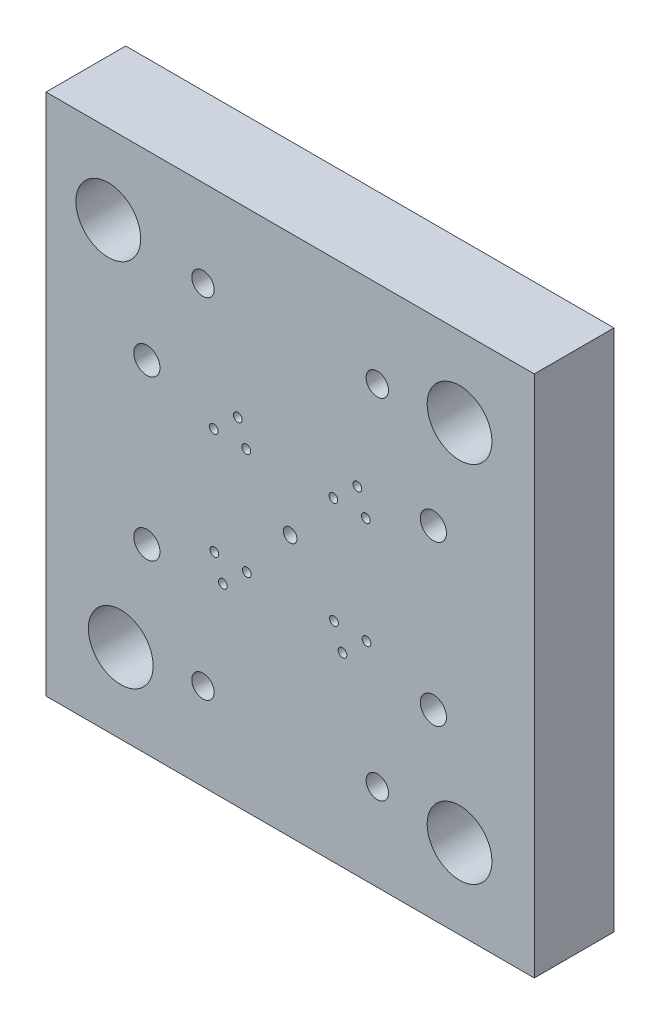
SolidWorks part; units mm, degrees
ref_plane "Plan de face" through (0, 0, 0) normal (0, 0, 1) x (1, 0, 0)
ref_plane "Plan de dessus" through (0, 0, 0) normal (0, 1, 0) x (1, 0, 0)
ref_plane "Plan de droite" through (0, 0, 0) normal (1, 0, 0) x (0, 0, -1)
sketch "Esquisse1" plane through (0, 0, 0) normal (0, 0, 1) x (1, 0, 0)
  line L1 (0, 0) -> (196, 0)
  line L2 (0, 0) -> (0, 210)
  line L3 (0, 210) -> (196, 210)
  line L4 (196, 0) -> (196, 210)
  dimension "D1" = 210
  dimension "D2" = 196
extrude "Extrusion1" add sketch "Esquisse1" along normal blind 32
sketch "Esquisse3" plane through (0, 0, 0) normal (0, 0, -1) x (-1, 0, 0)
  line L0 (-98, 210) -> (-98, 0) construction
  line L1 (-196, 210) -> (0, 210) construction
  line L2 (0, 0) -> (-196, 0) construction
  line L3 (-196, 105) -> (0, 105) construction
  line L4 (-196, 0) -> (-196, 210) construction
  line L5 (0, 210) -> (0, 0) construction
  line L6 (-214.75, 178) -> (45.0645, 178) construction
  line L7 (-218.7232, 32) -> (22.112, 32) construction
  line L8 (-166, 220.8332) -> (-166, -13.5838) construction
  line L9 (-30, 217.4713) -> (-30, -13.5838) construction
  line L10 (-25, 197.6571) -> (-25, 137.5989) construction
  circle A0 centre (-25, 178) radius 13
  circle A1 centre (-30, 32) radius 13
  circle A2 centre (-166, 32) radius 13
  circle A3 centre (-166, 178) radius 13
  dimension "D6" = 73
  dimension "D7" = 26
  dimension "D9" = 26
  dimension "D5" = 26
  dimension "D8" = 26
  dimension "D1" = 73
  dimension "D2" = 73
  dimension "D3" = 68
  dimension "D4" = 68
extrude "Enlèv. mat.-Extru.1" cut sketch "Esquisse3" against normal through all
sketch "Esquisse17" plane through (0, 0, 0) normal (0, 0, -1) x (-1, 0, 0)
  line L0 (-197.2908, 105) -> (0, 105) construction
  line L1 (0, 210) -> (0, 0) construction
  line L2 (-98, 210) -> (-98, 0) construction
  line L3 (-196, 210) -> (0, 210) construction
  line L4 (0, 0) -> (-196, 0) construction
  circle A0 centre (-40.5, 137) radius 5.25
  circle A1 centre (-40.5, 73) radius 5.25
  circle A2 centre (-155.5, 73) radius 5.25
  circle A3 centre (-155.5, 137) radius 5.25
  circle A4 centre (-98, 105) radius 2.75
  dimension "D1" = 10.5
  dimension "D2" = 10.5
  dimension "D3" = 10.5
  dimension "D4" = 10.5
  dimension "D5" = 32
  dimension "D6" = 32
  dimension "D7" = 32
  dimension "D9" = 57.5
  dimension "D10" = 57.5
  dimension "D11" = 57.5
  dimension "D13" = 5.5
  dimension "D8" = 32
  dimension "D12" = 57.5
extrude "Enlèv. mat.-Extru.9" cut sketch "Esquisse17" against normal through all
sketch "Esquisse19" plane through (0, 0, 0) normal (0, 0, -1) x (-1, 0, 0)
  line L0 (-98, 210) -> (-98, 0) construction
  line L1 (-196, 210) -> (0, 210) construction
  line L2 (0, 0) -> (-196, 0) construction
  line L3 (0, 105) -> (-196, 105) construction
  line L4 (0, 210) -> (0, 0) construction
  line L5 (-196, 0) -> (-196, 210) construction
  circle A1 centre (-67.36, 126.58) radius 1.75
  circle A2 centre (-80.41, 126.07) radius 1.75
  circle A3 centre (-76.99, 135.41) radius 1.75
  circle A4 centre (-67.59, 83.93) radius 1.75
  circle A5 centre (-71.01, 74.59) radius 1.75
  circle A6 centre (-80.64, 83.42) radius 1.75
  circle A7 centre (-128.64, 83.42) radius 1.75
  circle A8 centre (-115.59, 83.93) radius 1.75
  circle A9 centre (-119.01, 74.59) radius 1.75
  circle A13 centre (-124.99, 135.41) radius 1.75
  circle A14 centre (-128.41, 126.07) radius 1.75
  circle A15 centre (-115.36, 126.58) radius 1.75
  dimension "D7" = 3.5
  dimension "D8" = 3.5
  dimension "D9" = 3.5
  dimension "D16" = 3.5
  dimension "D17" = 3.5
  dimension "D18" = 3.5
  dimension "D1" = 21.58
  dimension "D2" = 30.41
  dimension "D3" = 21.07
  dimension "D4" = 30.64
  dimension "D5" = 21.01
  dimension "D6" = 17.59
  dimension "D10" = 21.07
  dimension "D11" = 21.58
  dimension "D12" = 30.41
  dimension "D13" = 30.41
  dimension "D14" = 26.99
  dimension "D15" = 17.36
extrude "Enlèv. mat.-Extru.10" cut sketch "Esquisse19" against normal through all
sketch "Esquisse20" plane through (0, 0, 0) normal (0, 0, -1) x (-1, 0, 0)
  line L0 (-98, 210) -> (-98, 0) construction
  line L1 (-196, 210) -> (0, 210) construction
  line L2 (0, 0) -> (-196, 0) construction
  line L3 (0, 105) -> (-196, 105) construction
  line L4 (0, 210) -> (0, 0) construction
  line L5 (-196, 0) -> (-196, 210) construction
  circle A0 centre (-63, 35) radius 4.5
  circle A1 centre (-63, 175) radius 4.5
  circle A2 centre (-133, 175) radius 4.5
  circle A3 centre (-133, 35) radius 4.5
  dimension "D1" = 9
  dimension "D2" = 70
  dimension "D3" = 35
extrude "Enlèv. mat.-Extru.11" cut sketch "Esquisse20" against normal through all
